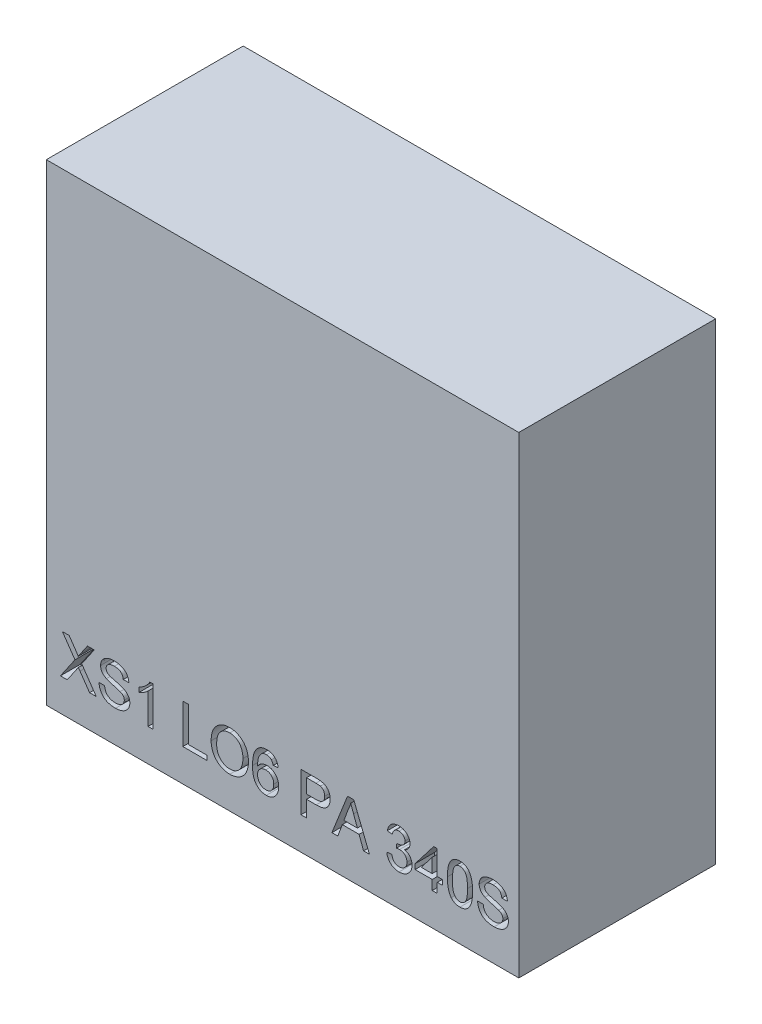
SolidWorks part; units mm, degrees
ref_plane "Plan de face" through (0, 0, 0) normal (0, 0, 1) x (1, 0, 0)
ref_plane "Plan de dessus" through (0, 0, 0) normal (0, 1, 0) x (1, 0, 0)
ref_plane "Plan de droite" through (0, 0, 0) normal (1, 0, 0) x (0, 0, -1)
sketch "Esquisse1" plane through (0, 0, 0) normal (0, 0, 1) x (1, 0, 0)
  line L1 (-6, -6) -> (6, -6)
  line L2 (-6, -6) -> (-6, 6)
  line L3 (-6, 6) -> (6, 6)
  line L4 (6, -6) -> (6, 6)
  point P4 (0, 6)
  point P6 (6, 0)
  dimension "D1" = 12
extrude "Extrusion1" add sketch "Esquisse1" along normal mid plane 5
sketch "Esquisse2" plane through (0, 0, 2.5) normal (0, 0, 1) x (1, 0, 0)
  text T0 "XS1 LO6 PA 340S" font "Arial" height 1
extrude "Enlèv. mat.-Extru.1" cut sketch "Esquisse2" against normal blind 0.5
